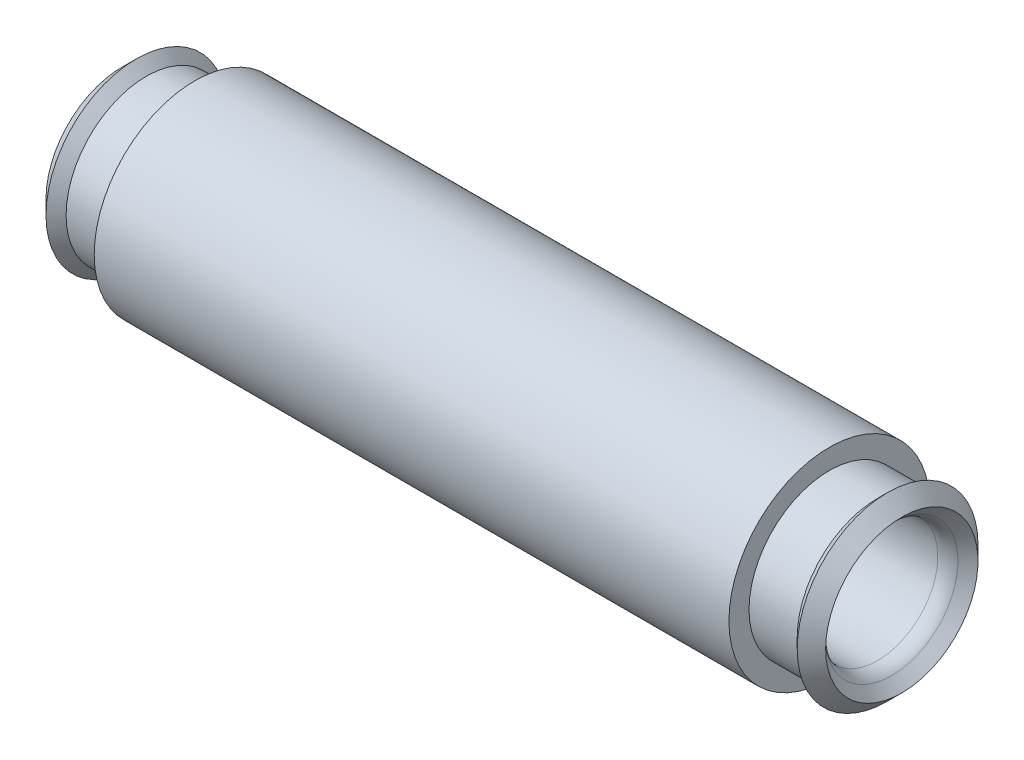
SolidWorks part; units mm, degrees
ref_plane "Front Plane" through (0, 0, 0) normal (0, 0, 1) x (1, 0, 0)
ref_plane "Top Plane" through (0, 0, 0) normal (0, 1, 0) x (1, 0, 0)
ref_plane "Right Plane" through (0, 0, 0) normal (1, 0, 0) x (0, 0, -1)
sketch "Sketch1" plane through (0, 0, 0) normal (0, 0, 1) x (1, 0, 0)
  line L0 (-108.4453, 0) -> (49891.5547, 0) construction
  line L1 (55, 0) -> (-55, 0) construction
  line L2 (-3.95, 1.25) -> (3.95, 1.25)
  line L3 (3.95, 1.25) -> (3.95, 1)
  line L4 (3.95, 1) -> (4.55, 1)
  line L6 (-3.95, 1.25) -> (-3.95, 1)
  line L7 (-3.95, 1) -> (-4.55, 1)
  line L9 (-4.55, 0.75) -> (4.55, 0.75)
  line L10 (0, -55) -> (0, 55) construction
  line L11 (-4.55, 1) -> (-4.675, 1.125)
  line L12 (-4.675, 1.125) -> (-4.8518, 0.9482)
  line L13 (-4.8518, 0.9482) -> (-4.7268, 0.8232)
  line L14 (4.55, 1) -> (4.675, 1.125)
  line L15 (4.675, 1.125) -> (4.8518, 0.9482)
  line L16 (4.8518, 0.9482) -> (4.7268, 0.8232)
  arc A1 (-4.7268, 0.8232) -> (-4.55, 0.75) centre (-4.55, 1) ccw
  arc A2 (4.7268, 0.8232) -> (4.55, 0.75) centre (4.55, 1) cw
  point P17 (0, 1.25)
  dimension "D1" = 2
  dimension "D6" = 0.6
  dimension "D2" = 7.9
  dimension "D4" = 2.5
  dimension "D5" = 1.5
  dimension "D7" = 45
  dimension "D8" = 2.25
revolve "Revolve1" add sketch "Sketch1" angle 360 about L0
